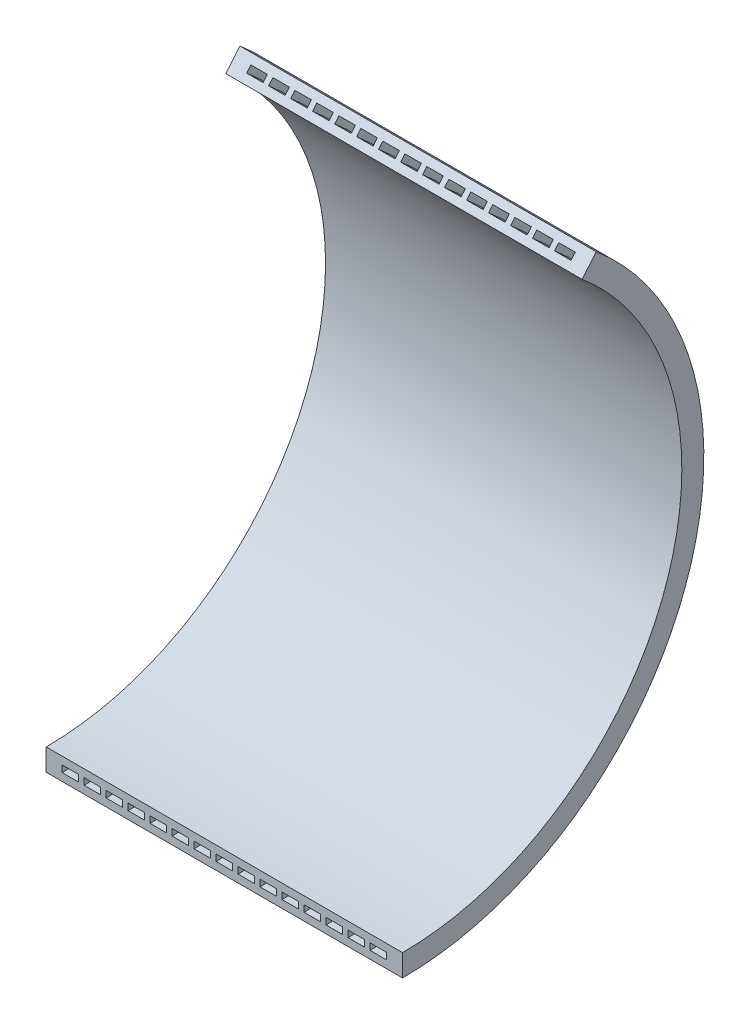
SolidWorks part; units mm, degrees
ref_plane "Přední rovina" through (0, 0, 0) normal (0, 0, 1) x (1, 0, 0)
ref_plane "Horní rovina" through (0, 0, 0) normal (0, 1, 0) x (1, 0, 0)
ref_plane "Pravá rovina" through (0, 0, 0) normal (1, 0, 0) x (0, 0, -1)
sketch "Skica1" plane through (0, 0, 0) normal (0, 0, 1) x (1, 0, 0)
  line L0 (10, 0) -> (10, 3)
  line L1 (0, 0) -> (7.5, 0)
  line L2 (0, 0) -> (0, 3)
  line L3 (0, 3) -> (7.5, 3)
  line L4 (7.5, 0) -> (7.5, 3)
  line L5 (10, 3) -> (17.5, 3)
  line L6 (17.5, 0) -> (17.5, 3)
  line L7 (10, 0) -> (17.5, 0)
  line L8 (20, 0) -> (20, 3)
  line L9 (20, 3) -> (27.5, 3)
  line L10 (27.5, 0) -> (27.5, 3)
  line L11 (20, 0) -> (27.5, 0)
  line L12 (30, 0) -> (30, 3)
  line L13 (30, 3) -> (37.5, 3)
  line L14 (37.5, 0) -> (37.5, 3)
  line L15 (30, 0) -> (37.5, 0)
  line L16 (40, 0) -> (40, 3)
  line L17 (40, 3) -> (47.5, 3)
  line L18 (47.5, 0) -> (47.5, 3)
  line L19 (40, 0) -> (47.5, 0)
  line L20 (50, 0) -> (50, 3)
  line L21 (50, 3) -> (57.5, 3)
  line L22 (57.5, 0) -> (57.5, 3)
  line L23 (50, 0) -> (57.5, 0)
  line L24 (60, 0) -> (60, 3)
  line L25 (60, 3) -> (67.5, 3)
  line L26 (67.5, 0) -> (67.5, 3)
  line L27 (60, 0) -> (67.5, 0)
  line L28 (70, 0) -> (70, 3)
  line L29 (70, 3) -> (77.5, 3)
  line L30 (77.5, 0) -> (77.5, 3)
  line L31 (70, 0) -> (77.5, 0)
  line L32 (80, 0) -> (80, 3)
  line L33 (80, 3) -> (87.5, 3)
  line L34 (87.5, 0) -> (87.5, 3)
  line L35 (80, 0) -> (87.5, 0)
  line L36 (90, 0) -> (90, 3)
  line L37 (90, 3) -> (97.5, 3)
  line L38 (97.5, 0) -> (97.5, 3)
  line L39 (90, 0) -> (97.5, 0)
  line L40 (100, 0) -> (100, 3)
  line L41 (100, 3) -> (107.5, 3)
  line L42 (107.5, 0) -> (107.5, 3)
  line L43 (100, 0) -> (107.5, 0)
  line L44 (110, 0) -> (110, 3)
  line L45 (110, 3) -> (117.5, 3)
  line L46 (117.5, 0) -> (117.5, 3)
  line L47 (110, 0) -> (117.5, 0)
  line L48 (120, 0) -> (120, 3)
  line L49 (120, 3) -> (127.5, 3)
  line L50 (127.5, 0) -> (127.5, 3)
  line L51 (120, 0) -> (127.5, 0)
  line L52 (130, 0) -> (130, 3)
  line L53 (130, 3) -> (137.5, 3)
  line L54 (137.5, 0) -> (137.5, 3)
  line L55 (130, 0) -> (137.5, 0)
  line L56 (140, 0) -> (140, 3)
  line L57 (140, 3) -> (147.5, 3)
  line L58 (147.5, 0) -> (147.5, 3)
  line L59 (140, 0) -> (147.5, 0)
  line L60 (0, 0) -> (10, 0) construction
  line L61 (0, 3) -> (7.5, 0) construction
  line L62 (-11.2265, 1.5) -> (152.7122, 1.5) construction
  line L63 (3.75, 1.5) -> (-7.25, 1.5) construction
  line L64 (-7.25, 1.5) -> (-7.25, -3.5) construction
  line L65 (140, 3) -> (147.5, 0) construction
  line L66 (143.75, 1.5) -> (154.75, 1.5)
  line L67 (154.75, 1.5) -> (154.75, 6.5) construction
  line L68 (-7.25, 1.5) -> (-7.25, 133.5) construction
  line L69 (-7.25, -3.5) -> (154.75, -3.5)
  line L70 (-7.25, -3.5) -> (-7.25, 6.5)
  line L71 (-7.25, 6.5) -> (154.75, 6.5)
  line L72 (154.75, -3.5) -> (154.75, 6.5)
  line L73 (-7.25, 133.5) -> (24, 133.5) construction
  dimension "D1" = 7.5
  dimension "D2" = 3
  dimension "D4" = 10
  dimension "D5" = 11
  dimension "D6" = 5
  dimension "D7" = 11
  dimension "D8" = 5
  dimension "D9" = 132
  dimension "D10" = 162
  dimension "D3" = 15
revolve "Rotovat1" add sketch "Skica1" angle 140 about L73
sketch "Skica4" plane through (0, 0, 0) normal (0, 1, 0) x (1, 0, 0)
  line L1 (17.5, 0) -> (17.5, -12.035) construction
  line L2 (28.75, -9.5093) -> (17.5, -9.5093) construction
  arc A0 (27.5, 0) -> (30, 0) centre (28.75, 0) ccw
  arc A1 (20, 0) -> (37.5, 0) centre (28.75, -2.1065) ccw
  arc A2 (28.75, -9.5093) -> (17.5, 0) centre (28.75, 1.9) cw
  arc A3 (28.75, -9.5093) -> (40, 0) centre (28.75, 1.9) ccw
sketch "Skica6" plane through (0, 0, 0) normal (0, 0, 1) x (1, 0, 0)
  line L1 (20, 0) -> (27.5, 0)
  line L2 (20, 0) -> (20, 3)
  line L3 (20, 3) -> (27.5, 3)
  line L4 (27.5, 0) -> (27.5, 3)
  line L5 (10, 0) -> (17.5, 0)
  line L6 (10, 0) -> (10, 3)
  line L7 (10, 3) -> (17.5, 3)
  line L8 (17.5, 0) -> (17.5, 3)
  line L9 (0, 0) -> (7.5, 0)
  line L10 (0, 0) -> (0, 3)
  line L11 (0, 3) -> (7.5, 3)
  line L12 (7.5, 0) -> (7.5, 3)
scale "Měřítko1" scale about origin uniform scaling yes scale factor 0.655
sketch "Skica7" [suppressed] plane through (-4.7487, 0, 0) normal (-1, 0, 0) x (0, 0, 1)
  line L0 (0, -2.2925) -> (0, 87.4425) construction
